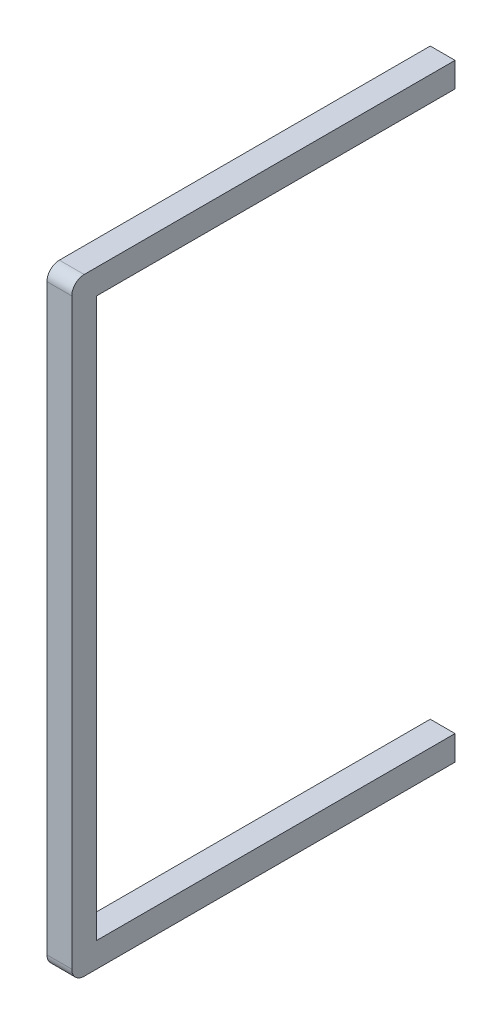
SolidWorks part; units mm, degrees
ref_plane "Front Plane" through (0, 0, 0) normal (0, 0, 1) x (1, 0, 0)
ref_plane "Top Plane" through (0, 0, 0) normal (0, 1, 0) x (1, 0, 0)
ref_plane "Right Plane" through (0, 0, 0) normal (1, 0, 0) x (0, 0, -1)
sketch "Sketch3" plane through (0, 0, 0) normal (0, 0, 1) x (1, 0, 0)
  line L1 (-1519.3372, 44.6353) -> (-1518.3372, 44.6353)
  line L2 (-1519.3372, 44.6353) -> (-1519.3372, 20.1353)
  line L3 (-1519.3372, 20.1353) -> (-1518.3372, 20.1353)
  line L4 (-1518.3372, 44.6353) -> (-1518.3372, 20.1353)
  dimension "D1" = 24.5
  dimension "D2" = 1
extrude "Boss-Extrude1" add sketch "Sketch3" along normal blind 1
sketch "Sketch4" plane through (0, 0, 0) normal (0, 0, -1) x (-1, 0, 0)
  line L0 (1519.3372, 44.6353) -> (1519.3372, 20.1353) construction
  line L1 (1518.3372, 44.6353) -> (1519.3372, 44.6353)
  line L2 (1518.3372, 44.6353) -> (1518.3372, 43.6353)
  line L3 (1518.3372, 43.6353) -> (1519.3372, 43.6353)
  line L4 (1519.3372, 44.6353) -> (1519.3372, 43.6353)
  line L7 (1518.3372, 20.1353) -> (1519.3372, 20.1353)
  line L8 (1518.3372, 20.1353) -> (1518.3372, 21.1353)
  line L9 (1518.3372, 21.1353) -> (1519.3372, 21.1353)
  line L10 (1519.3372, 20.1353) -> (1519.3372, 21.1353)
  dimension "D1" = 1
  dimension "D2" = 1
extrude "Boss-Extrude2" add sketch "Sketch4" along normal blind 14.45
fillet "Fillet1" radius 0.5 2 edges at (-1518.8372, 44.6353, 1) (-1518.8372, 20.1353, 1)
